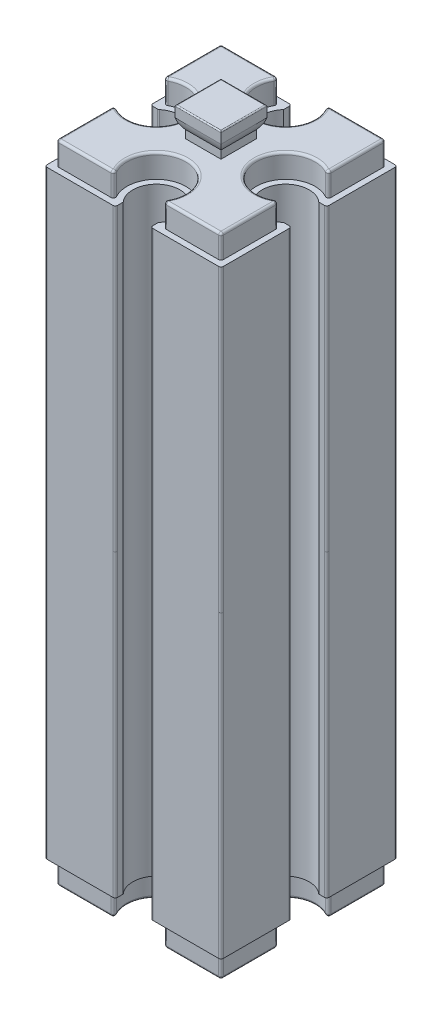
SolidWorks part; units mm, degrees
ref_plane "前视基准面" through (0, 0, 0) normal (0, 0, 1) x (1, 0, 0)
ref_plane "上视基准面" through (0, 0, 0) normal (0, 1, 0) x (1, 0, 0)
ref_plane "右视基准面" through (0, 0, 0) normal (1, 0, 0) x (0, 0, -1)
sketch "草图1" plane through (0, 0, 0) normal (0, 1, 0) x (1, 0, 0)
  line L0 (0, 0) -> (0, 7.5) construction
  line L1 (0, 0) -> (7.5, 0) construction
  line L2 (-7.5, 7.5) -> (-1.5, 7.5)
  line L3 (7.5, 7.5) -> (7.5, 1.5)
  line L4 (6.8229, 1.5) -> (7.5, 1.5)
  line L5 (6.8229, -1.5) -> (7.5, -1.5)
  line L6 (0, 7.5) -> (0, 5.5) construction
  line L7 (-1.5, 6.8229) -> (-1.5, 7.5)
  line L8 (1.5, 6.8229) -> (1.5, 7.5)
  line L9 (1.5, 7.5) -> (7.5, 7.5)
  line L10 (7.5, -1.5) -> (7.5, -7.5)
  line L11 (7.5, -7.5) -> (1.5, -7.5)
  line L12 (1.5, -6.8229) -> (1.5, -7.5)
  line L13 (-1.5, -6.8229) -> (-1.5, -7.5)
  line L14 (-1.5, -7.5) -> (-7.5, -7.5)
  line L15 (-7.5, -7.5) -> (-7.5, -1.5)
  line L16 (-6.8229, -1.5) -> (-7.5, -1.5)
  line L17 (-6.8229, 1.5) -> (-7.5, 1.5)
  line L18 (-7.5, 1.5) -> (-7.5, 7.5)
  arc A0 (-1.5, 6.8229) -> (1.5, 6.8229) centre (0, 5.5) ccw
  arc A1 (6.8229, 1.5) -> (6.8229, -1.5) centre (5.5, 0) ccw
  arc A2 (1.5, -6.8229) -> (-1.5, -6.8229) centre (0, -5.5) ccw
  arc A3 (-6.8229, -1.5) -> (-6.8229, 1.5) centre (-5.5, 0) ccw
  point P36 (0, 0)
  dimension "D6" = 4
  dimension "D7" = 2
  dimension "D1" = 7.5
  dimension "D2" = 7.5
  dimension "D3" = 2
  dimension "D4" = 7.5
  dimension "D5" = 1.5
extrude "凸台-拉伸1" add sketch "草图1" along normal blind 25.5
sketch "草图2" plane through (0, 25.5, 0) normal (0, 1, 0) x (1, 0, 0)
  line L0 (-7, 7) -> (-7, 2)
  line L1 (-7, 2) -> (-7, 2)
  line L2 (-7, -2) -> (-7, -2)
  line L3 (-7, -2) -> (-7, -7)
  line L4 (-7, -7) -> (-2, -7)
  line L5 (-2, -7) -> (-2, -7)
  line L6 (2, -7) -> (2, -7)
  line L7 (2, -7) -> (7, -7)
  line L8 (7, -7) -> (7, -2)
  line L9 (7, -2) -> (7, -2)
  line L10 (7, 2) -> (7, 2)
  line L11 (7, 2) -> (7, 7)
  line L12 (7, 7) -> (2, 7)
  line L13 (2, 7) -> (2, 7)
  line L14 (-2, 7) -> (-2, 7)
  line L15 (-2, 7) -> (-7, 7)
  line L16 (-7.5, 7.5) -> (-7.5, 1.5)
  line L17 (-7.5, 1.5) -> (-6.8229, 1.5)
  line L18 (-6.8229, -1.5) -> (-7.5, -1.5)
  line L19 (-7.5, -1.5) -> (-7.5, -7.5)
  line L20 (-7.5, -7.5) -> (-1.5, -7.5)
  line L21 (-1.5, -7.5) -> (-1.5, -6.8229)
  line L22 (1.5, -6.8229) -> (1.5, -7.5)
  line L23 (1.5, -7.5) -> (7.5, -7.5)
  line L24 (7.5, -7.5) -> (7.5, -1.5)
  line L25 (7.5, -1.5) -> (6.8229, -1.5)
  line L26 (6.8229, 1.5) -> (7.5, 1.5)
  line L27 (7.5, 1.5) -> (7.5, 7.5)
  line L28 (7.5, 7.5) -> (1.5, 7.5)
  line L29 (1.5, 7.5) -> (1.5, 6.8229)
  line L30 (-1.5, 6.8229) -> (-1.5, 7.5)
  line L31 (-1.5, 7.5) -> (-7.5, 7.5)
  line L32 (-7.5, 7.5) -> (-7.5, 1.5) construction
  line L33 (-7.5, 1.5) -> (-6.8229, 1.5) construction
  line L34 (-6.8229, -1.5) -> (-7.5, -1.5) construction
  line L35 (-7.5, -1.5) -> (-7.5, -7.5) construction
  line L36 (-7.5, -7.5) -> (-1.5, -7.5) construction
  line L37 (-1.5, -7.5) -> (-1.5, -6.8229) construction
  line L38 (1.5, -6.8229) -> (1.5, -7.5) construction
  line L39 (1.5, -7.5) -> (7.5, -7.5) construction
  line L40 (7.5, -7.5) -> (7.5, -1.5) construction
  line L41 (7.5, -1.5) -> (6.8229, -1.5) construction
  line L42 (6.8229, 1.5) -> (7.5, 1.5) construction
  line L43 (7.5, 1.5) -> (7.5, 7.5) construction
  line L44 (7.5, 7.5) -> (1.5, 7.5) construction
  line L45 (1.5, 7.5) -> (1.5, 6.8229) construction
  line L46 (-1.5, 6.8229) -> (-1.5, 7.5) construction
  line L47 (-1.5, 7.5) -> (-7.5, 7.5) construction
  arc A0 (-7, -2) -> (-7, 2) centre (-5.5, 0) ccw
  arc A1 (2, -7) -> (-2, -7) centre (0, -5.5) ccw
  arc A2 (7, 2) -> (7, -2) centre (5.5, 0) ccw
  arc A3 (-2, 7) -> (2, 7) centre (0, 5.5) ccw
  arc A4 (-6.8229, -1.5) -> (-6.8229, 1.5) centre (-5.5, 0) ccw
  arc A5 (1.5, -6.8229) -> (-1.5, -6.8229) centre (0, -5.5) ccw
  arc A6 (6.8229, 1.5) -> (6.8229, -1.5) centre (5.5, 0) ccw
  arc A7 (-1.5, 6.8229) -> (1.5, 6.8229) centre (0, 5.5) ccw
  arc A8 (-6.8229, -1.5) -> (-6.8229, 1.5) centre (-5.5, 0) ccw construction
  arc A9 (1.5, -6.8229) -> (-1.5, -6.8229) centre (0, -5.5) ccw construction
  arc A10 (6.8229, 1.5) -> (6.8229, -1.5) centre (5.5, 0) ccw construction
  arc A11 (-1.5, 6.8229) -> (1.5, 6.8229) centre (0, 5.5) ccw construction
  dimension "D1" = 0
  dimension "D2" = 0.5
extrude "凸台-拉伸2" add sketch "草图2" along normal blind 2
sketch "草图3" plane through (0, 0, 0) normal (1, 0, 0) x (0, 0, -1)
  line L0 (0, 27.5) -> (0, 29.5) construction
  line L1 (2.5, 27.5) -> (-2.5, 27.5) construction
  line L2 (0, 29.5) -> (0, 30) construction
  line L3 (-1.5, 27.5) -> (1.5, 27.5)
  line L4 (1.5, 27.5) -> (1.5, 28.1771)
  line L5 (-1.95, 30) -> (1.95, 30)
  line L6 (1.95, 30) -> (1.95, 29.0556)
  line L7 (-1.5, 27.5) -> (-1.5, 28.1771)
  line L8 (-1.95, 30) -> (-1.95, 29.0556)
  arc A0 (-1.5, 28.1771) -> (-1.95, 29.0556) centre (0, 29.5) cw
  arc A1 (1.5, 28.1771) -> (1.95, 29.0556) centre (0, 29.5) ccw
  dimension "D5" = 2
  dimension "D1" = 2
  dimension "D2" = 0.5
  dimension "D3" = 1.5
  dimension "D4" = 1.95
extrude "凸台-拉伸3" add sketch "草图3" along normal blind 2 and the other way blind 2
sketch "草图4" plane through (0, 0, 0) normal (0, 0, 1) x (1, 0, 0)
  line L0 (0, 27.5) -> (0, 29.5) construction
  line L2 (-2, 27.5) -> (2, 27.5) construction
  line L3 (0, 29.5) -> (0, 30) construction
  line L4 (-2, 30) -> (2, 30) construction
  line L5 (1.95, 30) -> (2, 30)
  line L6 (-1.95, 30) -> (-1.95, 29.0556)
  line L9 (-1.5, 27.5) -> (-1.5, 28.1771)
  line L10 (1.5, 27.5) -> (1.5, 28.1771)
  line L11 (1.95, 30) -> (1.95, 29.0556)
  line L12 (1.5, 27.5) -> (2, 27.5)
  line L13 (-2, 30) -> (-1.95, 30)
  line L14 (-2, 30) -> (-2, 27.5)
  line L15 (-2, 27.5) -> (-1.5, 27.5)
  line L16 (2, 30) -> (2, 27.5)
  arc A0 (-1.95, 29.0556) -> (-1.5, 28.1771) centre (0, 29.5) ccw
  arc A1 (1.95, 29.0556) -> (1.5, 28.1771) centre (0, 29.5) cw
  dimension "D1" = 2
  dimension "D2" = 1.5
  dimension "D3" = 1.95
fillet "圆角3" radius 0.2 13 edges at (-1.5, 12.75, -7.5) (1.5, 12.75, -7.5) (7.5, 12.75, -7.5) (7.5, 12.75, -1.5) (7.5, 12.75, 1.5) (7.5, 12.75, 7.5) (-1.5, 12.75, 7.5) (1.5, 12.75, 7.5) (-6.8229, 12.75, -1.5) (-7.5, 12.75, 7.5) (-7.5, 12.75, 1.5) (-7.5, 12.75, -1.5) (-7.5, 12.75, -7.5)
extrude "切除-拉伸1" cut sketch "草图4" against normal blind 3 and the other way blind 3
fillet "圆角4" radius 0.2 24 edges at (0, 27.5, 3) (-3, 27.5, 0) (0, 27.5, -3) (3, 27.5, 0) (7, 26.5, 2) (7, 26.5, -2) (2, 26.5, -7) (-2, 26.5, -7) (-7, 26.5, 2) (-7, 26.5, -2) (2, 26.5, 7) (-2, 26.5, 7) (7, 26.5, 7) (4.5, 27.5, 7) (7, 27.5, 4.5) (7, 27.5, -4.5) (7, 26.5, -7) (4.5, 27.5, -7) (-4.5, 27.5, -7) (-7, 26.5, -7) (-7, 27.5, -4.5) (-4.5, 27.5, 7) (-7, 27.5, 4.5) (-7, 26.5, 7)
fillet "圆角5" radius 0.1 4 edges at (0, 30, -1.95) (1.95, 30, 0) (0, 30, 1.95) (-1.95, 30, 0)
mirror "镜向1" of "圆角5", "圆角4", "切除-拉伸1", "圆角3", "凸台-拉伸3", "凸台-拉伸2", "凸台-拉伸1"
